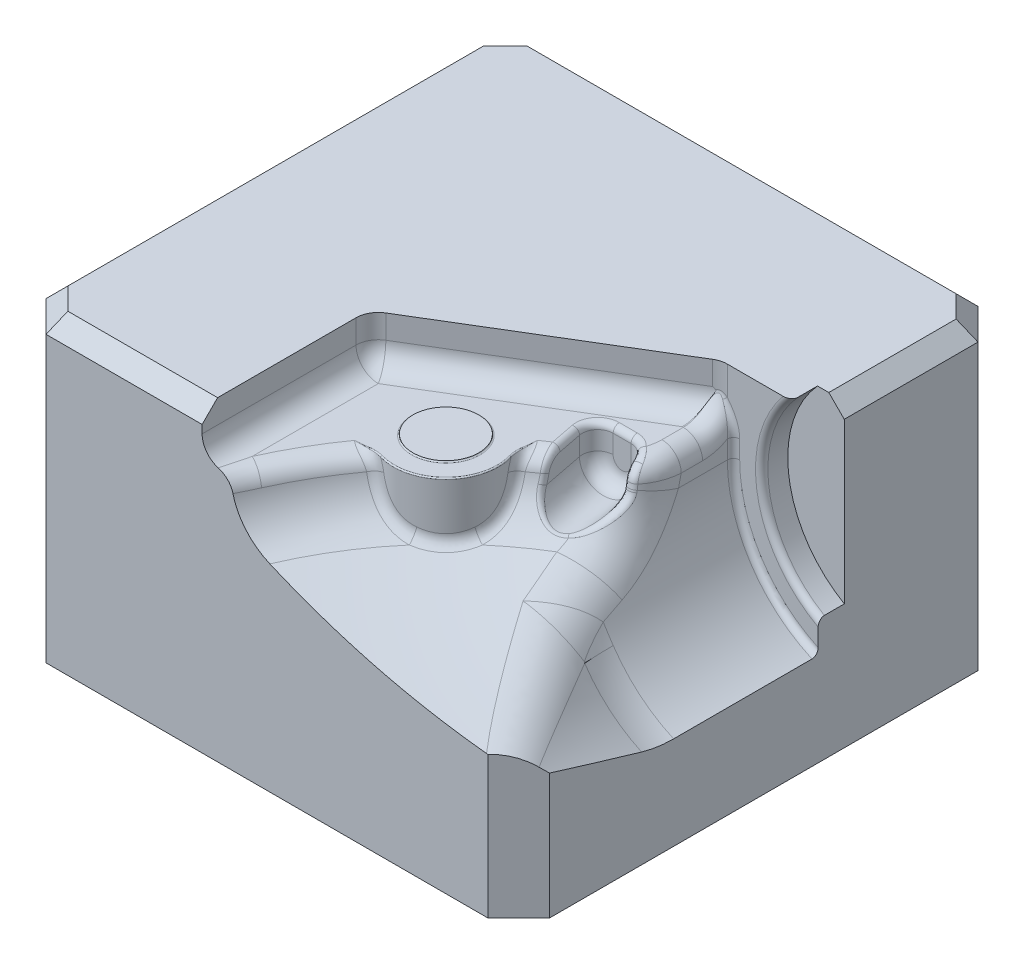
SolidWorks part; units mm, degrees
ref_plane "Front Plane" through (0, 0, 0) normal (0, 0, 1) x (1, 0, 0)
ref_plane "Top Plane" through (0, 0, 0) normal (0, 1, 0) x (1, 0, 0)
ref_plane "Right Plane" through (0, 0, 0) normal (1, 0, 0) x (0, 0, -1)
body saved out of another part "Mold Rework"
sketch "Contain" plane through (0, -79.375, 0) normal (0, -1, 0) x (1, 0, 0)
  line L0 (42.3749, 10.2168) -> (38.6861, 10.2168) construction
  line L1 (48.1055, 15.9599) -> (48.0628, 15.781) construction
  line L2 (34.3243, 15.5178) -> (35.3041, 20.5102) construction
  line L3 (42.3749, 10.2168) -> (38.6861, 10.2168)
  line L4 (48.1055, 15.9599) -> (48.0628, 15.781)
  line L5 (34.3243, 15.5178) -> (35.3041, 20.5102)
  arc A0 (34.3243, 15.5178) -> (38.6861, 10.2168) centre (38.6861, 14.6618) ccw construction
  arc A1 (42.3749, 10.2168) -> (45.6663, 11.6743) centre (42.3749, 14.6618) ccw construction
  arc A2 (34.3243, 15.5178) -> (38.6861, 10.2168) centre (38.6861, 14.6618) ccw
  arc A3 (42.3749, 10.2168) -> (45.6663, 11.6743) centre (42.3749, 14.6618) ccw
  spline S0 degree 3 poles (1841.5468, -869.5438) (-155.6175, 82.1554) (63.3538, 35.9746) (46.641, 12.6529) (46.4668, 12.4418) (24.585, -10.7119) (-201.5673, 97.8248) (-1946.2925, 184.4567) knots -26.093826 -26.093826 -26.093826 -26.093826 0.5 0.5 0.75 0.75 29.543866 29.543866 29.543866 29.543866 only from (47.497, 14.191) to (45.6663, 11.6743) construction
  spline S1 degree 3 poles (-537.0242, -1896.6353) (-8.7426, -144.2433) (50.6237, 23.0936) (47.9625, 15.4941) (47.9205, 15.3744) (47.8221, 15.0963) (47.765, 14.9355) (40.6339, -4.9839) (-35.8259, -203.6379) (536.3924, 1953.3491) knots -20.125838 -20.125838 -20.125838 -20.125838 0.25 0.25 0.5 0.5 0.75 0.75 28.806664 28.806664 28.806664 28.806664 only from (48.0628, 15.781) to (47.497, 14.191) construction
  spline S2 degree 3 poles (-19.5179, -1982.4682) (208.8132, 2272.0227) (-142.9723, -2185.2889) (235.8741, 2007.0622) knots -0.162306 -0.162306 -0.162306 -0.162306 0.119709 0.119709 0.119709 0.119709 only from (48.1273, 16.0503) to (48.1055, 15.9599) construction
  spline S3 degree 3 poles (-1461.2775, -1291.2162) (-17.7137, 17.0573) (33.6135, 38.1696) (44.9463, 24.3153) (45.1025, 24.1044) (45.3953, 23.6779) (45.5327, 23.4614) (45.9236, 22.8052) (46.1564, 22.3588) (46.5836, 21.4577) (46.7777, 21.0025) (47.1335, 20.0913) (47.2929, 19.641) (47.5786, 18.7601) (47.705, 18.3291) (47.8674, 17.7103) (47.9172, 17.5079) (48.0037, 17.1259) (48.0409, 16.9454) (48.0998, 16.6141) (48.1216, 16.4619) (48.759, 8.9303) (10.7876, 94.5281) (-868.8316, 1793.3481) knots -4.096429 -4.096429 -4.096429 -4.096429 0.125 0.125 0.1875 0.1875 0.25 0.25 0.375 0.375 0.5 0.5 0.625 0.625 0.75 0.75 0.8125 0.8125 0.875 0.875 0.9375 0.9375 4.659621 4.659621 4.659621 4.659621 only from (43.6482, 25.6062) to (48.1273, 16.0503) construction
  spline S4 degree 3 poles (1866.0701, -782.7126) (241.267, -19.9143) (28.4663, 13.6305) (36.9166, 25.4363) (36.9852, 25.5161) (37.1437, 25.6736) (37.2342, 25.7517) (37.5325, 25.9771) (37.7674, 26.1176) (38.3085, 26.3728) (38.6187, 26.4886) (39.2914, 26.669) (39.6559, 26.7354) (40.4439, 26.7884) (40.8526, 26.7737) (41.6984, 26.6258) (42.1132, 26.4951) (42.7166, 26.2133) (42.9135, 26.1055) (63.7065, 13.1519) (2.7149, -123.3338) (1196.257, 1659.4268) knots -8.931676 -8.931676 -8.931676 -8.931676 0.125 0.125 0.1875 0.1875 0.25 0.25 0.375 0.375 0.5 0.5 0.625 0.625 0.75 0.75 0.875 0.875 0.9375 0.9375 7.768107 7.768107 7.768107 7.768107 only from (36.6408, 24.8556) to (43.6482, 25.6062) construction
  spline S5 degree 3 poles (408.7632, 1989.2888) (-538.7343, -2868.3014) (810.6586, 3503.4833) (-678.2778, -1834.3971) knots -102.984661 -102.984661 -102.984661 -102.984661 210.557939 210.557939 210.557939 210.557939 only from (36.552, 24.319) to (36.6408, 24.8556) construction
  spline S6 degree 3 poles (-24.4591, -1973.9455) (-128.7693, -544.1863) (10.8698, -54.4128) (35.7814, 21.9795) (35.8467, 22.1792) (35.9707, 22.558) (36.03, 22.7387) (36.143, 23.0824) (36.1969, 23.2458) (36.2943, 23.5412) (36.3385, 23.675) (36.4177, 23.9143) (36.4529, 24.0204) (40.1127, 35.0551) (-45.645, -224.8012) (-639.929, -1857.7012) knots -46.259324 -46.259324 -46.259324 -46.259324 0.25 0.25 0.375 0.375 0.5 0.5 0.625 0.625 0.75 0.75 0.875 0.875 16.446255 16.446255 16.446255 16.446255 only from (35.3041, 20.5102) to (36.552, 24.319) construction
  spline S7 degree 3 poles (47.497, 14.191) (47.336, 13.747) (47.1079, 13.3045) (46.641, 12.6529) (46.4668, 12.4418) (46.0901, 12.0432) (45.8863, 11.8539) (45.6663, 11.6743) knots 0 0 0 0 0.5 0.5 0.75 0.75 1 1 1 1
  spline S8 degree 3 poles (48.0628, 15.781) (48.0499, 15.7441) (48.027, 15.6783) (47.9625, 15.4941) (47.9205, 15.3744) (47.8221, 15.0963) (47.765, 14.9355) (47.639, 14.5836) (47.5705, 14.3935) (47.497, 14.191) knots 0 0 0 0 0.25 0.25 0.5 0.5 0.75 0.75 1 1 1 1
  spline S9 degree 3 poles (48.1273, 16.0503) (48.1197, 16.0175) (48.1124, 15.9873) (48.1055, 15.9599) knots 0 0 0 0 0.00041 0.00041 0.00041 0.00041
  spline S10 degree 3 poles (43.6482, 25.6062) (44.0844, 25.2955) (44.4502, 24.9217) (44.9463, 24.3153) (45.1025, 24.1044) (45.3953, 23.6779) (45.5327, 23.4614) (45.9236, 22.8052) (46.1564, 22.3588) (46.5836, 21.4577) (46.7777, 21.0025) (47.1335, 20.0913) (47.2929, 19.641) (47.5786, 18.7601) (47.705, 18.3291) (47.8674, 17.7103) (47.9172, 17.5079) (48.0037, 17.1259) (48.0409, 16.9454) (48.0998, 16.6141) (48.1216, 16.4619) (48.1427, 16.2132) (48.1423, 16.115) (48.1273, 16.0503) knots 0 0 0 0 0.125 0.125 0.1875 0.1875 0.25 0.25 0.375 0.375 0.5 0.5 0.625 0.625 0.75 0.75 0.8125 0.8125 0.875 0.875 0.9375 0.9375 1 1 1 1
  spline S11 degree 3 poles (36.6408, 24.8556) (36.6692, 25.0276) (36.7429, 25.1936) (36.9166, 25.4363) (36.9852, 25.5161) (37.1437, 25.6736) (37.2342, 25.7517) (37.5325, 25.9771) (37.7674, 26.1176) (38.3085, 26.3728) (38.6187, 26.4886) (39.2914, 26.669) (39.6559, 26.7354) (40.4439, 26.7884) (40.8526, 26.7737) (41.6984, 26.6258) (42.1132, 26.4951) (42.7166, 26.2133) (42.9135, 26.1055) (43.2906, 25.8706) (43.4723, 25.7428) (43.6482, 25.6062) knots 0 0 0 0 0.125 0.125 0.1875 0.1875 0.25 0.25 0.375 0.375 0.5 0.5 0.625 0.625 0.75 0.75 0.875 0.875 0.9375 0.9375 1 1 1 1
  spline S12 degree 3 poles (36.552, 24.319) (36.5754, 24.4605) (36.6051, 24.6396) (36.6408, 24.8556) knots 0 0 0 0 1 1 1 1
  spline S13 degree 3 poles (35.3041, 20.5102) (35.4442, 20.9437) (35.5811, 21.3652) (35.7814, 21.9795) (35.8467, 22.1792) (35.9707, 22.558) (36.03, 22.7387) (36.143, 23.0824) (36.1969, 23.2458) (36.2943, 23.5412) (36.3385, 23.675) (36.4177, 23.9143) (36.4529, 24.0204) (36.5112, 24.1962) (36.5346, 24.2666) (36.552, 24.319) knots 0 0 0 0 0.25 0.25 0.375 0.375 0.5 0.5 0.625 0.625 0.75 0.75 0.875 0.875 1 1 1 1
chamfer "Chamfer1" distance 6.35 angle 45 4 edges at (67.4435, -65.6333, 59.6285) (-35.9627, -39.6875, -41.0153) (67.4435, -39.6875, -41.0153) (-35.9627, -39.6875, 59.6285)
other "Move Face1" parameters "D1"=17.78
chamfer "Chamfer3" distance 3.175 angle 45 7 edges at (67.4435, -17.78, -20.9365) (64.2685, -17.78, -37.8403) (15.7404, -17.78, -41.0153) (-32.7877, -17.78, -37.8403) (-35.9627, -17.78, 9.3066) (-32.7877, -17.78, 56.4535) (-13.585, -17.78, 59.6285)
